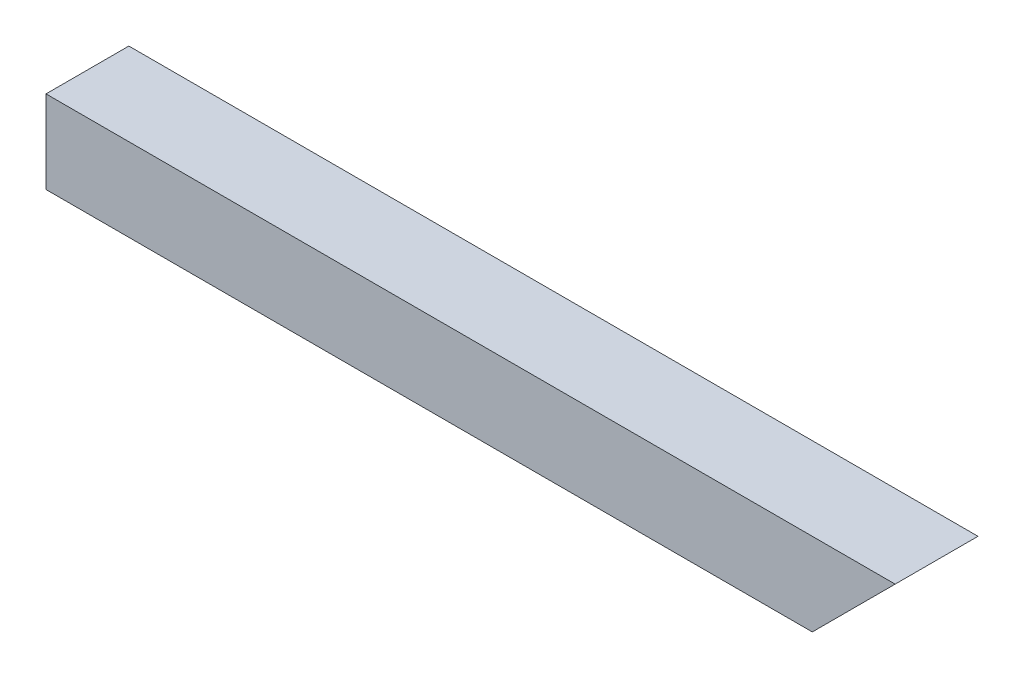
SolidWorks part; units mm, degrees
ref_plane "Plan de face" through (0, 0, 0) normal (0, 0, 1) x (1, 0, 0)
ref_plane "Plan de dessus" through (0, 0, 0) normal (0, 1, 0) x (1, 0, 0)
ref_plane "Plan de droite" through (0, 0, 0) normal (1, 0, 0) x (0, 0, -1)
sketch "Esquisse1" plane through (0, 0, 0) normal (0, 0, 1) x (1, 0, 0)
  line L0 (0, 410) -> (410, 410)
  line L1 (410, 410) -> (370, 370)
  line L2 (370, 370) -> (0, 370)
  line L3 (0, 370) -> (0, 410)
extrude "Boss.-Extru.1" add sketch "Esquisse1" against normal blind 40
